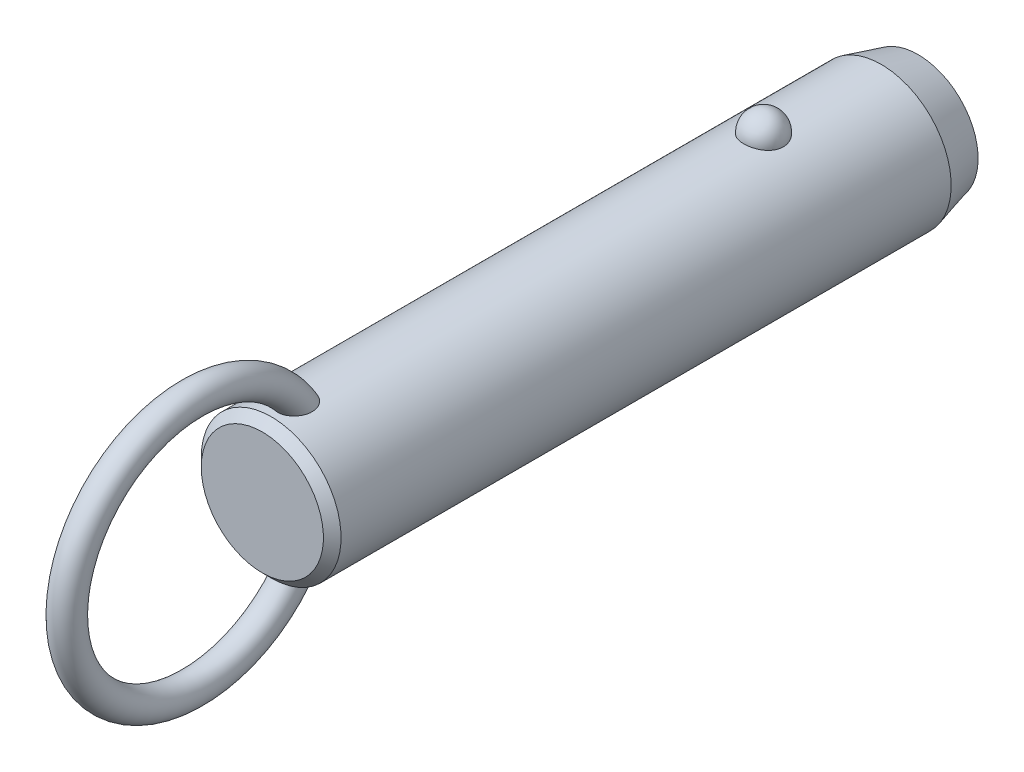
SolidWorks part; units mm, degrees
ref_plane "Front Plane" through (0, 0, 0) normal (0, 0, 1) x (1, 0, 0)
ref_plane "Top Plane" through (0, 0, 0) normal (0, 1, 0) x (1, 0, 0)
ref_plane "Right Plane" through (0, 0, 0) normal (1, 0, 0) x (0, 0, -1)
sketch "Sketch2" plane through (0, 0, 0) normal (0, 0, 1) x (1, 0, 0)
  circle A0 centre (0, 0) radius 9.5
  point P3 (0, 9.5)
  dimension "D1" = 19
extrude "Boss-Extrude1" add sketch "Sketch2" along normal blind 55.9
sketch "Sketch3" plane through (0, 0, 0) normal (0, 0, -1) x (-1, 0, 0)
  circle A0 centre (0, 0) radius 9.5
  dimension "D1" = 19
extrude "Boss-Extrude2" add sketch "Sketch3" along normal blind 23.7
chamfer "Chamfer1" distance 5 angle 15 1 edges at (-9.5, 0, -23.7)
sketch "Sketch12" plane through (0, 0, 0) normal (1, 0, 0) x (0, 0, -1)
  line L0 (-55.9, 9.5) -> (-55.9, -9.5) construction
  point P0 (-55.9, 0)
sketch "Sketch13" plane through (0, 0, 0) normal (1, 0, 0) x (0, 0, -1)
  circle A0 centre (-74.95, 0) radius 19.05
  point P2 (-55.9, 0)
  dimension "D1" = 38.1
sketch "Sketch14" plane through (0, 0, 0) normal (0, 1, 0) x (1, 0, 0)
  circle A0 centre (0, -57.9) radius 2
  point P2 (0, -55.9)
  dimension "D1" = 4
sweep "Sweep1" add profiles "Sketch14" path "Sketch13"
sketch "Sketch15" plane through (0, 0, 55.9) normal (0, 0, 1) x (1, 0, 0)
  circle A0 centre (0, 0) radius 9.5
  dimension "D1" = 19
extrude "Boss-Extrude3" add sketch "Sketch15" along normal blind 9.52
chamfer "Chamfer2" distance 1.2 angle 45 1 edges at (9.5, 0, 65.42)
sketch "Sketch18" plane through (0, 0, 0) normal (1, 0, 0) x (0, 0, -1)
  line L0 (18.7, 9.5) -> (-58.4378, 9.5) construction
  line L1 (2.7, 12.2) -> (2.7, 6.8)
  line L2 (-58.4378, -9.5) -> (18.7, -9.5) construction
  arc A0 (2.7, 12.2) -> (2.7, 6.8) centre (2.7, 9.5) ccw
  point P4 (0, 9.5)
  dimension "D1" = 21.7
revolve "Revolve1" add sketch "Sketch18" angle 360 about L1
